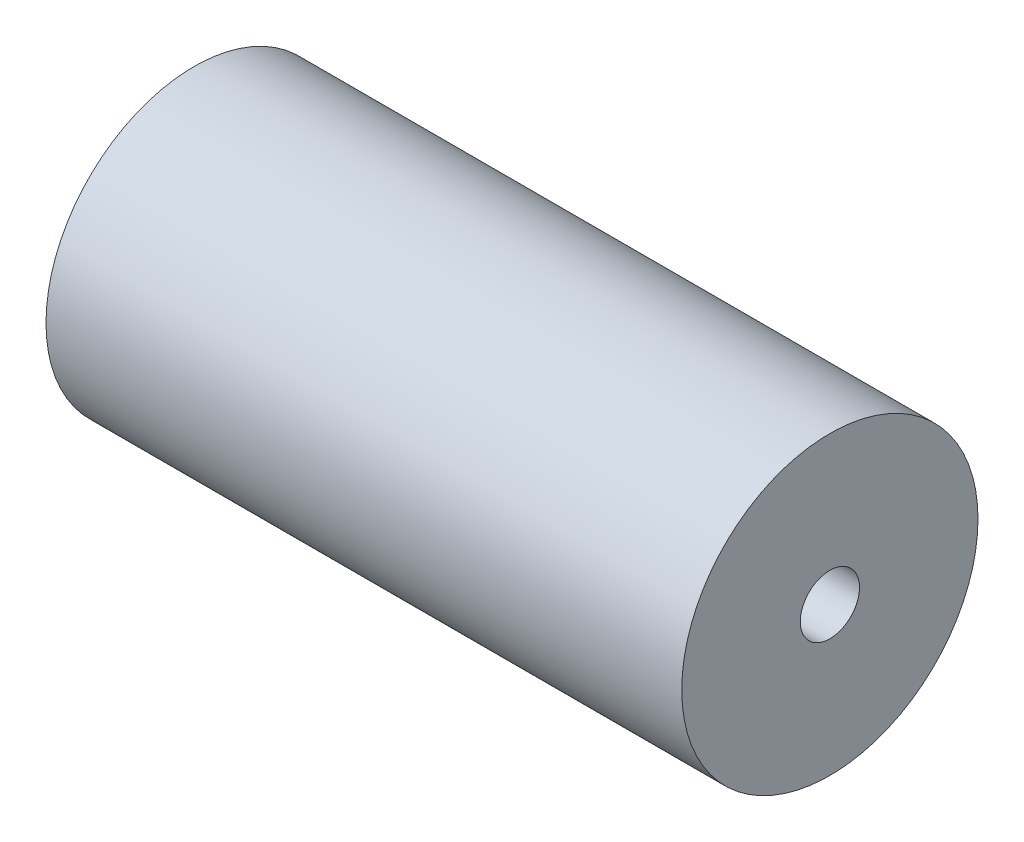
SolidWorks part; units mm, degrees
ref_plane "Front Plane" through (0, 0, 0) normal (0, 0, 1) x (1, 0, 0)
ref_plane "Top Plane" through (0, 0, 0) normal (0, 1, 0) x (1, 0, 0)
ref_plane "Right Plane" through (0, 0, 0) normal (1, 0, 0) x (0, 0, -1)
sketch "Sketch1" plane through (0, 0, 0) normal (1, 0, 0) x (0, 0, -1)
  circle A0 centre (0, 0) radius 25
  circle A1 centre (0, 0) radius 5
  dimension "D1" = 50
  dimension "D2" = 10
extrude "Boss-Extrude1" add sketch "Sketch1" along normal blind 107.3
